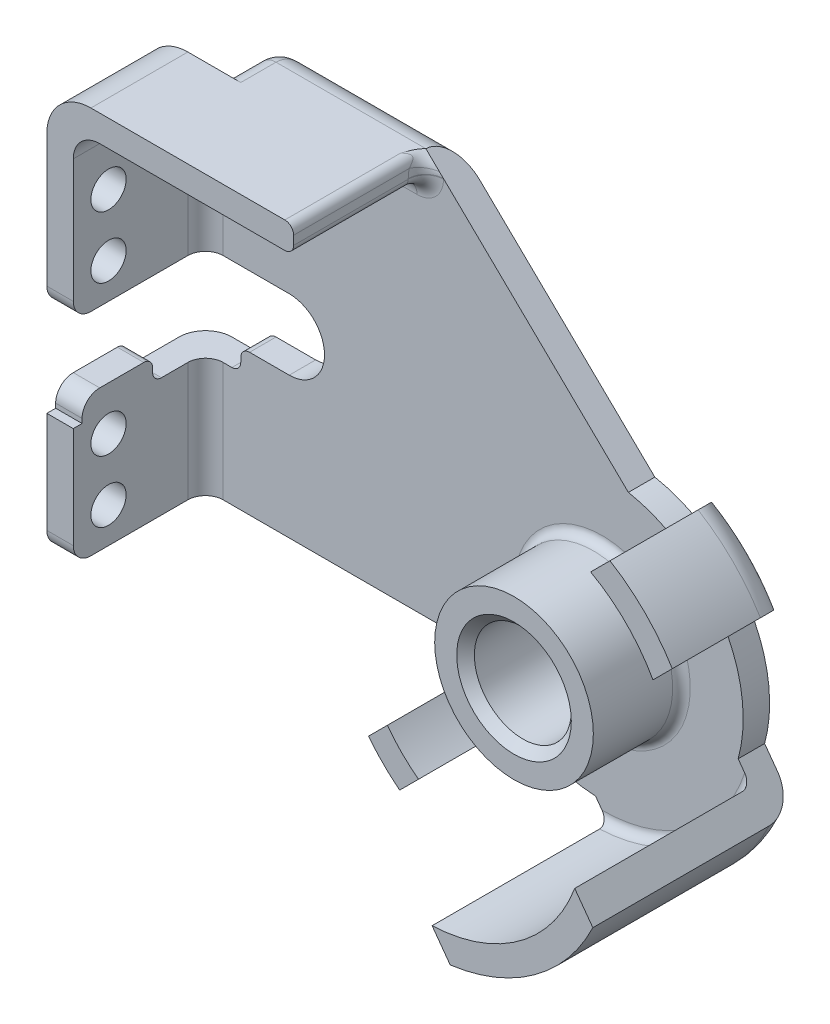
SolidWorks part; units mm, degrees
ref_plane "Plan de face" through (0, 0, 0) normal (0, 0, 1) x (1, 0, 0)
ref_plane "Plan de dessus" through (0, 0, 0) normal (0, 1, 0) x (1, 0, 0)
ref_plane "Plan de droite" through (0, 0, 0) normal (1, 0, 0) x (0, 0, -1)
sketch "Esquisse1" plane through (0, 0, 0) normal (0, 0, 1) x (1, 0, 0)
  line L1 (19.889, 31.021) -> (19.889, 15.021)
  line L2 (19.889, 4.521) -> (19.889, -8.979)
  line L4 (19.889, -8.979) -> (53.9393, -8.979)
  line L5 (47.889, 37.021) -> (70.8651, 14.7418)
  line L6 (19.889, 15.021) -> (32.389, 15.021)
  line L9 (19.889, 31.021) -> (26.889, 31.021)
  line L10 (28.889, 37.021) -> (28.889, 33.021)
  line L11 (19.889, 4.521) -> (25.889, 4.521)
  line L12 (32.389, 7.021) -> (27.889, 7.021)
  line L13 (26.889, 5.521) -> (26.889, 6.021)
  line L14 (67.889, -0.979) -> (97.2957, 28.4277) construction
  line L15 (57.5441, -0.979) -> (83.889, -0.979) construction
  line L16 (78.7757, 16.9787) -> (75.1006, 13.3036)
  line L17 (85.8468, 9.9077) -> (82.1717, 6.2326)
  line L18 (67.889, -0.979) -> (89.1574, -30.2524) construction
  line L19 (67.889, -0.979) -> (39.9511, -28.9169) construction
  line L20 (83.3206, -5.2058) -> (86.8334, -10.0406)
  line L21 (67.1403, -16.9615) -> (70.653, -21.7963)
  line L22 (54.6464, -10.6861) -> (51.3776, -13.9549)
  line L23 (58.482, -13.9215) -> (54.9132, -17.4904)
  line L24 (28.889, 37.021) -> (47.889, 37.021)
  arc A0 (28.889, 33.021) -> (26.889, 31.021) centre (26.889, 33.021) cw
  arc A1 (32.389, 7.021) -> (32.389, 15.021) centre (32.389, 11.021) ccw
  arc A2 (26.889, 5.521) -> (25.889, 4.521) centre (25.889, 5.521) cw
  arc A3 (27.889, 7.021) -> (26.889, 6.021) centre (27.889, 6.021) ccw
  arc A5 (51.3776, -13.9549) -> (54.9132, -17.4904) centre (67.889, -0.979) ccw
  arc A6 (75.1006, 13.3036) -> (70.8651, 14.7418) centre (67.889, -0.979) ccw
  arc A7 (83.3206, -5.2058) -> (82.1717, 6.2326) centre (67.889, -0.979) ccw
  arc A8 (85.8468, 9.9077) -> (78.7757, 16.9787) centre (67.889, -0.979) ccw
  arc A9 (58.482, -13.9215) -> (67.1403, -16.9615) centre (67.889, -0.979) ccw
  arc A10 (70.653, -21.7963) -> (86.8334, -10.0406) centre (67.889, -0.979) ccw
  arc A11 (53.9393, -8.979) -> (54.6464, -10.6861) centre (53.9393, -9.979) cw
  point P10 (28.889, 31.021)
  point P22 (26.889, 4.521)
  dimension "D1" = 2
  dimension "D4" = 8
  dimension "D5" = 12.5
  dimension "D11" = 1
  dimension "D15" = 6
  dimension "D18" = 42
  dimension "D28" = 1
  dimension "D2" = 9
  dimension "D3" = 7
  dimension "D6" = 24
  dimension "D7" = 13.5
  dimension "D12" = 44.118
  dimension "D13" = 46
  dimension "D14" = 28
  dimension "D19" = 45
  dimension "D20" = 5
  dimension "D21" = 10
  dimension "D22" = 54
  dimension "D23" = 45
  dimension "D24" = 2.5
  dimension "D25" = 5
  dimension "D26" = 10
  dimension "D27" = 20
extrude "Extrusion1" add sketch "Esquisse1" along normal blind 3
sketch "Esquisse2" plane through (0, 0, 3) normal (0, 0, 1) x (1, 0, 0)
  line L0 (82.1717, 6.2326) -> (85.8468, 9.9077) construction
  line L1 (83.6516, 7.7125) -> (85.8468, 9.9077)
  line L2 (78.7757, 16.9787) -> (75.1006, 13.3036) construction
  line L3 (78.7757, 16.9787) -> (76.5805, 14.7836)
  line L8 (54.9132, -17.4904) -> (58.482, -13.9215) construction
  line L9 (54.9132, -17.4904) -> (57.0522, -15.3513)
  line L10 (54.6464, -10.6861) -> (51.3776, -13.9549) construction
  line L11 (53.5167, -11.8158) -> (51.3776, -13.9549)
  arc A0 (51.3776, -13.9549) -> (54.9132, -17.4904) centre (67.889, -0.979) ccw
  arc A1 (53.5167, -11.8158) -> (57.0522, -15.3513) centre (67.889, -0.979) ccw
  arc A2 (85.8468, 9.9077) -> (78.7757, 16.9787) centre (67.889, -0.979) ccw construction
  circle A3 centre (67.889, -0.979) radius 9
  arc A4 (85.8468, 9.9077) -> (78.7757, 16.9787) centre (67.889, -0.979) ccw
  arc A5 (83.6516, 7.7125) -> (76.5805, 14.7836) centre (67.889, -0.979) ccw
  dimension "D1" = 36
  dimension "D2" = 18
extrude "Extrusion2" add sketch "Esquisse2" along normal blind 10
sketch "Esquisse3" plane through (0, 0, 3) normal (0, 0, 1) x (1, 0, 0)
  line L0 (86.8334, -10.0406) -> (83.3206, -5.2058) construction
  line L1 (86.8334, -10.0406) -> (84.7764, -7.2094)
  line L2 (67.1403, -16.9615) -> (70.653, -21.7963) construction
  line L3 (68.596, -18.9651) -> (70.653, -21.7963)
  arc A0 (70.653, -21.7963) -> (86.8334, -10.0406) centre (67.889, -0.979) ccw
  arc A1 (68.596, -18.9651) -> (84.7764, -7.2094) centre (67.889, -0.979) ccw
  arc A2 (70.653, -21.7963) -> (86.8334, -10.0406) centre (67.889, -0.979) ccw construction
  arc A3 (83.6516, 7.7125) -> (76.5805, 14.7836) centre (67.889, -0.979) ccw construction
extrude "Extrusion3" add sketch "Esquisse3" along normal blind 20
sketch "Esquisse4" plane through (0, 0, 13) normal (0, 0, 1) x (1, 0, 0)
  circle A0 centre (67.889, -0.979) radius 5.5
  dimension "D1" = 11
extrude "Enlèv. mat.-Extru.1" cut sketch "Esquisse4" against normal through all
chamfer "Chanfrein1" distance 1 angle 45 1 edges at (73.389, -0.979, 13)
sketch "Esquisse5" plane through (0, 0, 3) normal (0, 0, 1) x (1, 0, 0)
  line L0 (47.889, 37.021) -> (28.889, 37.021) construction
  line L1 (46.889, 37.021) -> (24.889, 37.021)
  line L2 (19.889, 31.021) -> (19.889, 15.021) construction
  line L3 (19.889, 32.021) -> (19.889, 15.021)
  line L4 (25.889, 4.521) -> (19.889, 4.521) construction
  line L5 (19.889, -8.979) -> (53.9393, -8.979) construction
  line L6 (19.889, -8.979) -> (22.889, -8.979)
  line L7 (22.889, -8.979) -> (22.889, 4.521)
  line L8 (25.889, 34.021) -> (46.889, 34.021)
  line L9 (47.889, 36.021) -> (47.889, 35.021)
  line L12 (19.889, 15.021) -> (32.389, 15.021) construction
  line L13 (19.889, 15.021) -> (22.889, 15.021)
  line L14 (22.889, 15.021) -> (22.889, 31.021)
  line L15 (19.889, 4.521) -> (19.889, -8.979)
  line L16 (22.889, 4.521) -> (19.889, 4.521)
  arc A0 (24.889, 37.021) -> (19.889, 32.021) centre (24.889, 32.021) ccw
  arc A1 (25.889, 34.021) -> (22.889, 31.021) centre (25.889, 31.021) ccw
  arc A2 (47.889, 36.021) -> (46.889, 37.021) centre (46.889, 36.021) ccw
  arc A3 (47.889, 35.021) -> (46.889, 34.021) centre (46.889, 35.021) cw
  dimension "D2" = 5
  dimension "D3" = 3
  dimension "D4" = 1
  dimension "D1" = 3
extrude "Extrusion4" add sketch "Esquisse5" along normal blind 15
sketch "Esquisse6" plane through (28.889, 0, 0) normal (-1, 0, 0) x (0, 0, 1)
  line L1 (0, 37.021) -> (7, 37.021)
  line L2 (0, 37.021) -> (0, 31.021)
  line L3 (0, 31.021) -> (7, 31.021)
  line L4 (7, 37.021) -> (7, 31.021)
  dimension "D1" = 7
  dimension "D2" = 6
extrude "Enlèv. mat.-Extru.2" cut sketch "Esquisse6" along normal blind 14
sketch "Esquisse7" plane through (19.889, 0, 0) normal (-1, 0, 0) x (0, 0, 1)
  line L1 (5.45, 4.521) -> (5.45, 1.5624)
  line L2 (17, 4.521) -> (17, 5.021)
  line L3 (15, 7.021) -> (10, 7.021)
  line L4 (9, 6.021) -> (9, 5.521)
  line L5 (18, 4.521) -> (0, 4.521) construction
  line L6 (8, 4.521) -> (5.45, 4.521)
  line L7 (5.45, 1.5624) -> (17, 1.5624)
  line L8 (17, 1.5624) -> (17, 4.521)
  arc A0 (15, 7.021) -> (17, 5.021) centre (15, 5.021) cw
  arc A1 (10, 7.021) -> (9, 6.021) centre (10, 6.021) ccw
  arc A2 (8, 4.521) -> (9, 5.521) centre (8, 5.521) ccw
  point P8 (17, 7.021)
  point P11 (9, 7.021)
  dimension "D3" = 2
  dimension "D4" = 1
  dimension "D5" = 1
  dimension "D1" = 8
  dimension "D2" = 2.5
extrude "Extrusion6" add sketch "Esquisse7" against normal blind 3
fillet "Congé1" radius 2 3 edges at (19.889, 31.021, 3.5) (28.889, 37.021, 3.5) (28.889, 31.021, 1.5)
fillet "Congé2" radius 1 4 edges at (78.4692, -15.5413, 3) (80.617, 11.7489, 3) (55.1611, -13.7069, 3) (58.889, -0.979, 3)
fillet "Congé3" radius 3 11 edges at (53.0398, -15.8282, 0) (80.2325, -17.9684, 0) (82.7383, 13.8702, 0) (29.4748, 36.4352, 0) (28.889, 34.021, 0) (28.3032, 31.6068, 0) (24.389, 31.021, 0) (20.4748, 30.4352, 0) (39.389, 37.021, 0) (19.889, 22.021, 0) (19.889, -2.229, 0)
sketch "Esquisse8" plane through (22.889, 0, 0) normal (1, 0, 0) x (0, 0, -1)
  line L0 (-18, 15.021) -> (-18, 31.021) construction
  line L1 (-18, -8.979) -> (-18, 4.521) construction
  line L2 (-18, 15.021) -> (-3, 15.021) construction
  circle A0 centre (-14, 19.021) radius 2
  circle A1 centre (-14, 26.021) radius 2
  circle A2 centre (-14, 2.021) radius 2
  circle A3 centre (-14, -4.979) radius 2
  dimension "D1" = 4
  dimension "D2" = 4
  dimension "D3" = 4
  dimension "D4" = 4
  dimension "D5" = 4
  dimension "D6" = 4
  dimension "D7" = 4
  dimension "D8" = 4
  dimension "D9" = 4
  dimension "D10" = 7
  dimension "D11" = 31
  dimension "D12" = 7
extrude "Enlèv. mat.-Extru.3" cut sketch "Esquisse8" against normal through all
fillet "Congé4" radius 2 2 edges at (21.389, 15.021, 18) (21.389, -8.979, 18)
fillet "Congé13" radius 2 6 edges at (47.5961, 36.7281, 3) (47.889, 35.521, 3) (47.5961, 34.3139, 3) (37.889, 34.021, 3) (22.889, 23.021, 3) (22.889, -2.229, 3)
